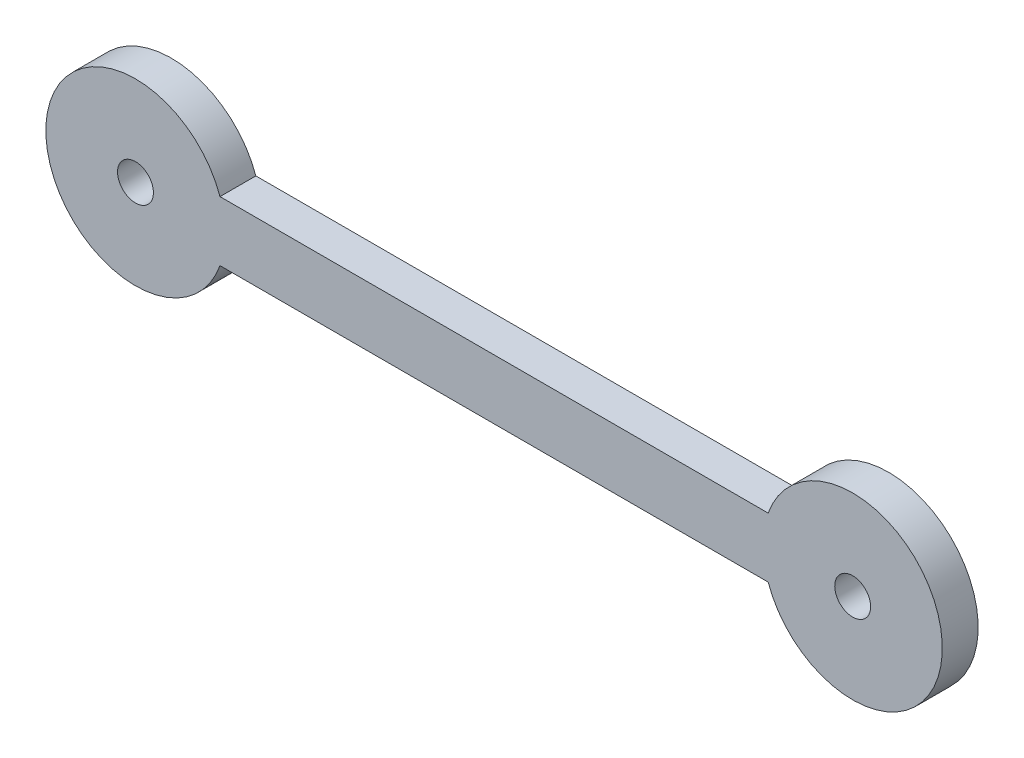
SolidWorks part; units mm, degrees
ref_plane "Plan de face" through (0, 0, 0) normal (0, 0, 1) x (1, 0, 0)
ref_plane "Plan de dessus" through (0, 0, 0) normal (0, 1, 0) x (1, 0, 0)
ref_plane "Plan de droite" through (0, 0, 0) normal (1, 0, 0) x (0, 0, -1)
sketch "Esquisse1" plane through (0, 0, 0) normal (0, 0, 1) x (1, 0, 0)
  line L0 (-42.4688, 0) -> (155.0416, 0) construction
  line L1 (0, 61.7728) -> (0, -62.5856) construction
  line L2 (60, 50.1167) -> (60, -48.5809) construction
  line L3 (1.9509, 5) -> (100, 5) construction
  line L5 (100, -5) -> (1.9509, -5) construction
  line L6 (14.1421, 5) -> (105.8579, 5)
  line L7 (0, 0) -> (135.9275, 135.9275) construction
  line L8 (105.8579, -5) -> (14.1421, -5)
  line L11 (120, 0) -> (0, 0) construction
  line L12 (120, 0) -> (120, 120) construction
  line L13 (120, 120) -> (0, 120) construction
  line L14 (0, 0) -> (0, 120) construction
  circle A0 centre (0, 0) radius 3
  arc A1 (14.1421, 5) -> (14.1421, -5) centre (0, 0) ccw
  arc A2 (105.8579, 5) -> (105.8579, -5) centre (120, 0) cw
  circle A3 centre (120, 0) radius 3
  dimension "D1" = 45
extrude "Extrusion2" add sketch "Esquisse1" along normal blind 6
